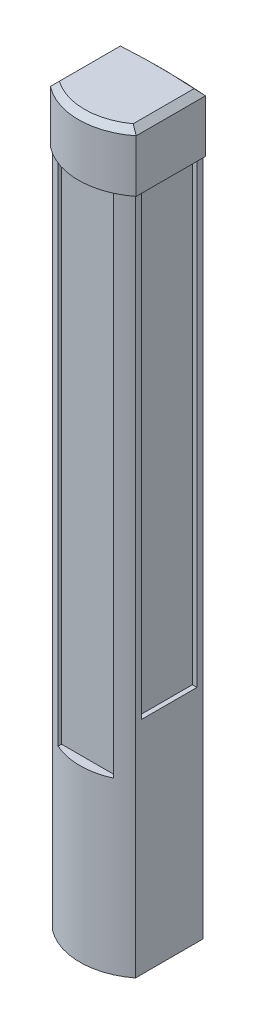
SolidWorks part; units mm, degrees
ref_plane "Ön Düzlem" through (0, 0, 0) normal (0, 0, 1) x (1, 0, 0)
ref_plane "Üst Düzlem" through (0, 0, 0) normal (0, 1, 0) x (1, 0, 0)
ref_plane "Sağ Düzlem" through (0, 0, 0) normal (1, 0, 0) x (0, 0, -1)
sketch "Çizim1" plane through (0, 0, 0) normal (0, 1, 0) x (1, 0, 0)
  line L0 (90.111, 76.6254) -> (90.111, -59.671)
  line L1 (-90.111, 75.9416) -> (-90.111, -59.671)
  line L2 (-90.111, 75.9416) -> (-90.111, 87.0912)
  line L3 (90.111, 76.6254) -> (90.111, 86.8586)
  arc A0 (-90.111, -59.671) -> (90.111, -59.671) centre (0, 57.0674) ccw
  arc A1 (-90.111, 87.0912) -> (90.111, 86.8586) centre (-1.5267, -1095.6012) cw
  dimension "D1" = 146.7622
extrude "Yükseklik-Ekstrüzyon1" add sketch "Çizim1" along normal blind 1600
sketch "Çizim2" plane through (0, 0, 0) normal (0, 0, 1) x (1, 0, 0)
  line L0 (90.111, 1600) -> (-90.111, 1600) construction
  line L1 (-60.111, 1475) -> (60.111, 1475)
  line L2 (-60.111, 1475) -> (-60.111, 370)
  line L3 (-60.111, 370) -> (60.111, 370)
  line L4 (60.111, 1475) -> (60.111, 370)
  line L5 (90.111, 1600) -> (90.111, 0) construction
  line L6 (-90.111, 1600) -> (-90.111, 0) construction
  line L7 (-90.111, 0) -> (90.111, 0) construction
  dimension "D1" = 125
  dimension "D2" = 30
  dimension "D3" = 30
  dimension "D4" = 370
extrude "Kes-Ekstrüzyon1" cut sketch "Çizim2" along normal blind 30 from offset 70 contours L1 L4 L3 L2
sketch "Çizim3" plane through (-90.111, 0, 0) normal (-1, 0, 0) x (0, 0, 1)
  line L0 (77.597, 1475) -> (90.4041, 1475) construction
  line L1 (-74.0912, 1475) -> (46.671, 1475)
  line L2 (-74.0912, 1475) -> (-74.0912, 480)
  line L3 (-74.0912, 480) -> (46.671, 480)
  line L4 (46.671, 1475) -> (46.671, 480)
  line L5 (-87.0912, 1600) -> (-87.0912, 0) construction
  line L6 (59.671, 1600) -> (59.671, 0) construction
  line L7 (90.4041, 370) -> (77.597, 370) construction
  dimension "D1" = 0
  dimension "D2" = 13
  dimension "D3" = 13
  dimension "D4" = 110
extrude "Kes-Ekstrüzyon2" cut sketch "Çizim3" against normal blind 10
mirror "Aynalama1" about plane through (0, 0, 0) normal (1, 0, 0) of "Kes-Ekstrüzyon2"
sketch "Çizim5" plane through (0, 0, 0) normal (0, 0, 1) x (1, 0, 0)
  line L0 (90.111, 1600) -> (90.111, 0) construction
  line L1 (60.111, 1475) -> (-60.111, 1475)
  line L2 (60.111, 1475) -> (60.111, 475)
  line L3 (60.111, 475) -> (-60.111, 475)
  line L4 (-60.111, 1475) -> (-60.111, 475)
  line L5 (-90.111, 1600) -> (-90.111, 0) construction
  line L6 (-60.111, 1475) -> (60.111, 1475) construction
  dimension "D1" = 30
  dimension "D2" = 0
  dimension "D3" = 30
  dimension "D4" = 1000
extrude "Kes-Ekstrüzyon3" cut sketch "Çizim5" against normal blind 20 from offset 80
sketch "Çizim6" plane through (0, 1600, 0) normal (0, 1, 0) x (1, 0, 0)
  line L0 (-93.111, 89.8717) -> (-93.111, -61.1359)
  line L1 (93.111, -61.1359) -> (93.111, 89.6318)
  line L2 (90.111, -59.671) -> (90.111, 86.8586)
  line L3 (-90.111, 87.0912) -> (-90.111, -59.671)
  line L4 (90.111, -59.671) -> (90.111, 86.8586)
  line L5 (-90.111, 87.0912) -> (-90.111, -59.671)
  arc A0 (-93.111, -61.1359) -> (93.111, -61.1359) centre (0, 57.0674) ccw
  arc A1 (93.111, 89.6318) -> (-93.111, 89.8717) centre (-1.5267, -1095.6012) ccw
  arc A2 (90.111, 86.8586) -> (-90.111, 87.0912) centre (-1.5267, -1095.6012) ccw
  arc A3 (-90.111, -59.671) -> (90.111, -59.671) centre (0, 57.0674) ccw
  arc A4 (90.111, 86.8586) -> (-90.111, 87.0912) centre (-1.5267, -1095.6012) ccw
  arc A5 (-90.111, -59.671) -> (90.111, -59.671) centre (0, 57.0674) ccw
  dimension "D1" = 0
  dimension "D2" = 3
extrude "Yükseklik-Ekstrüzyon3" add sketch "Çizim6" against normal blind 127
chamfer "Pah1" distance 13 angle 45 4 edges at (93.111, 1600, -14.248) (0.0047, 1600, -93.4031) (-93.111, 1600, -14.3679) (0, 1600, 93.4041)
